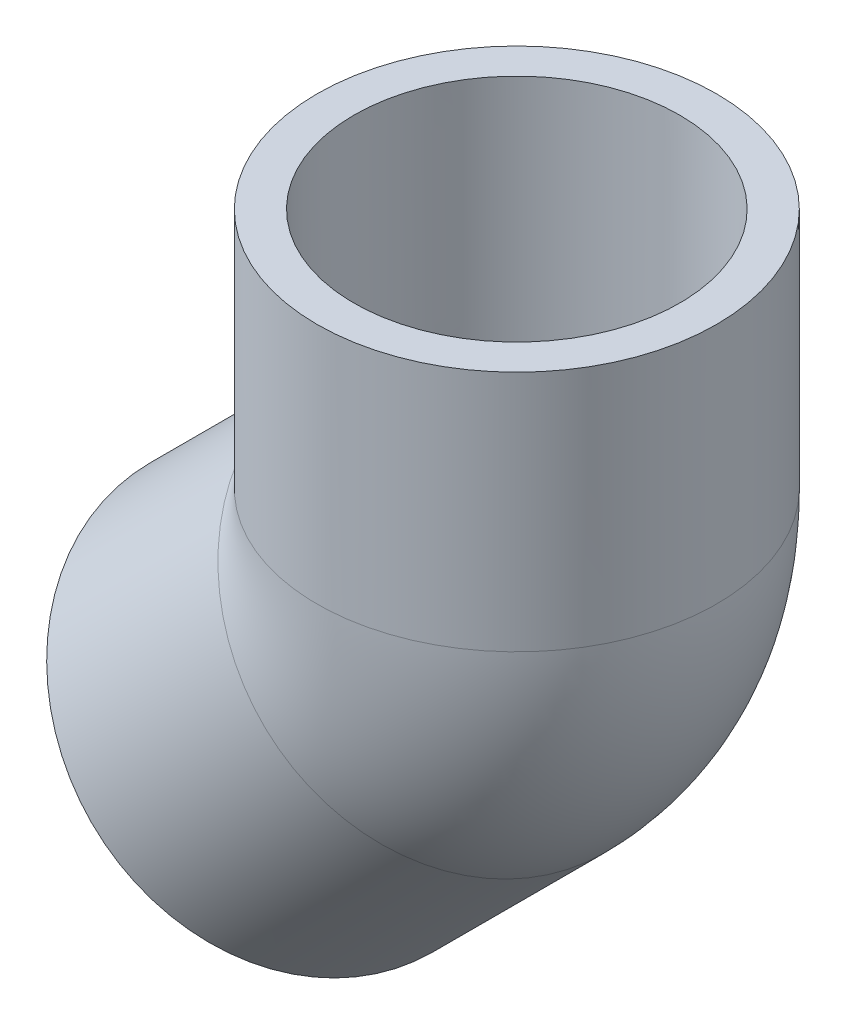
SolidWorks part; units mm, degrees
ref_plane "Front Plane" through (0, 0, 0) normal (0, 0, 1) x (1, 0, 0)
ref_plane "Top Plane" through (0, 0, 0) normal (0, 1, 0) x (1, 0, 0)
ref_plane "Right Plane" through (0, 0, 0) normal (1, 0, 0) x (0, 0, -1)
sketch "Sketch0" plane through (0, 0, 0) normal (0, 0, 1) x (1, 0, 0)
  line L0 (-23.2948, -23.2948) -> (0, 0) construction
  line L1 (0, 0) -> (0, 32.9438) construction
  line L2 (-5.6037, -5.6037) -> (0, 0) construction
  line L3 (0, 0) -> (0, 7.9248) construction
  line L4 (-37.8877, -8.7019) -> (-8.7019, -37.8877) construction
  line L5 (-17.3678, 6.1605) -> (-35.1936, -11.3959) construction
  line L6 (-17.3678, 6.1605) -> (6.1605, -17.3678) construction
  line L7 (6.1605, -17.3678) -> (-11.3959, -35.1936) construction
  line L8 (-35.1936, -11.3959) -> (-11.3959, -35.1936) construction
  line L9 (-20.6375, 32.9438) -> (20.6375, 32.9438) construction
  line L10 (-16.8275, 32.9438) -> (16.8275, 32.9438) construction
  line L11 (16.8275, 32.9438) -> (16.637, 7.9248) construction
  line L12 (16.637, 7.9248) -> (-16.637, 7.9248) construction
  line L13 (-16.637, 7.9248) -> (-16.8275, 32.9438) construction
  line L14 (-15.024, 3.8166) -> (3.8166, -15.024) construction
  line L18 (-13.3223, 7.9248) -> (13.3223, 7.9248) construction
  dimension "D1" = 45
  dimension "H" = 32.9438
  dimension "J" = 7.9248
  dimension "M" = 41.275
  dimension "OD A" = 33.655
  dimension "OD B" = 33.274
  dimension "ID" = 26.6446
sketch "Sketch1" plane through (0, 0, 0) normal (0, 0, 1) x (1, 0, 0)
  line L0 (-23.2948, -23.2948) -> (0, 0) construction
  line L1 (-23.2948, -23.2948) -> (0, 0) construction
  line L3 (-8.7019, -37.8877) -> (8.9892, -20.1966)
  line L4 (-8.7019, -37.8877) -> (-11.3959, -35.1936)
  line L5 (-11.3959, -35.1936) -> (6.1605, -17.3678)
  line L6 (8.9892, -20.1966) -> (6.1605, -17.3678)
revolve "Revolve1" add sketch "Sketch1" angle 360 about L1
sketch "Sketch2" plane through (0, 0, 0) normal (0, 0, 1) x (1, 0, 0)
  line L0 (16.8275, 32.9438) -> (16.637, 7.9248)
  line L1 (16.637, 7.9248) -> (20.6375, 7.9248)
  line L2 (20.6375, 7.9248) -> (20.6375, 32.9438)
  line L3 (20.6375, 32.9438) -> (16.8275, 32.9438)
  line L4 (0, 0) -> (0, 32.9438) construction
  line L5 (0, 0) -> (0, 32.9438) construction
revolve "Revolve2" add sketch "Sketch2" angle 360 about L5
sketch "Sketch3" plane through (-5.6037, -5.6037, 0) normal (0.7071, 0.7071, 0) x (0, 0, -1)
  line L0 (-7.7374, 19.1322) -> (7.7374, 19.1322)
  circle A0 centre (0, 0) radius 13.3223
  arc A1 (-7.7374, 19.1322) -> (7.7374, 19.1322) centre (0, 0) ccw
  ellipse E0 centre (0, 5.6037) end of major axis (-20.6375, 5.6037) minor radius 14.5929 construction
sketch "Sketch4" plane through (0, 0, 0) normal (0, 0, 1) x (1, 0, 0)
  line L0 (-23.2948, -23.2948) -> (0, 0) construction
  line L1 (0, 0) -> (0, 32.9438) construction
  line L2 (-23.2948, -23.2948) -> (-5.6037, -5.6037) construction
  line L3 (0, 7.9248) -> (0, 32.9438) construction
  arc A0 (-5.6037, -5.6037) -> (0, 7.9248) centre (-19.1322, 7.9248) ccw
sweep "Sweep1" add profiles "Sketch3" path "Sketch4"
